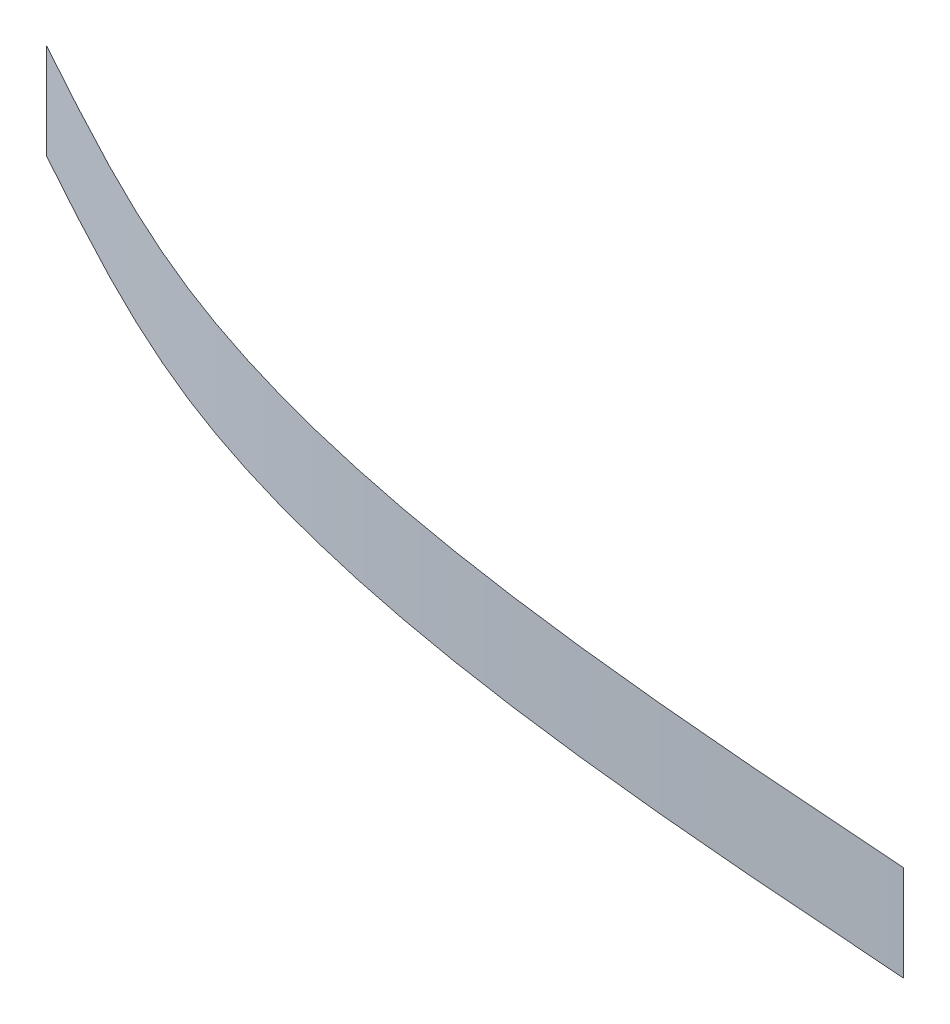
SolidWorks part; units mm, degrees
ref_plane "Ebene vorne" through (0, 0, 0) normal (0, 0, 1) x (1, 0, 0)
ref_plane "Ebene oben" through (0, 0, 0) normal (0, 1, 0) x (1, 0, 0)
ref_plane "Ebene rechts" through (0, 0, 0) normal (1, 0, 0) x (0, 0, -1)
sketch "Skizze1" plane through (0, 0, 0) normal (0, 1, 0) x (1, 0, 0)
  spline S0 degree 3 poles (0, 0) (-13.1052, 0.9056) (-43.8439, 3.0298) (-85.1773, 10.9073) (-109.9857, 24.5465) (-119.2184, 29.6225) knots 0 0 0 0 0.318154 0.746242 1 1 1 1
surface "Oberfläche-Linear austragen1" sketch "Skizze1" parameters "D1"=10
ref_plane "Ebene2" through (0, 10, 0) normal (0.9976, 0, 0.0689) x (0.0689, 0, -0.9976)
ref_plane "Ebene3" through (-120.6891, 0, -8.3402) normal (0.9976, 0, 0.0689) x (0.0689, 0, -0.9976)
ref_plane "Ebene4" through (1.4707, 0, -21.2823) normal (0.0689, 0, -0.9976) x (-0.9976, 0, -0.0689)
ref_plane "Ebene5" through (0, 0, 0) normal (-0.0689, 0, 0.9976) x (0.9976, 0, 0.0689)
sketch "Skizze3" plane through (1.4707, 0, -21.2823) normal (0.0689, 0, -0.9976) x (-0.9976, 0, -0.0689)
  line L3 (120.977, 33.782) -> (120.977, -33.782) construction
  arc A0 (120.977, 10) -> (105.977, 25) centre (105.977, 10) ccw
  dimension "D1" = 15
sketch3d "3D-Skizze1"
  spline S0 degree 3 poles (599.6954, 10, 1881.8165) (348.2237, 10, -108.0669) (139.3204, 10, 31.8785) (-208.2081, 10, -34.3551) (-262.2724, 10, -301.1886) (-1198.4746, 10, 1639.921) knots -4.431382 -4.431382 -4.431382 -4.431382 0.318154 0.746242 3.976544 3.976544 3.976544 3.976544 only from (0, 10, 0) to (-119.2184, 10, -29.6225) construction
  spline S1 degree 3 poles (0, 10, 0) (-13.1052, 10, -0.9056) (-43.8439, 10, -3.0298) (-85.1773, 10, -10.9073) (-109.9857, 10, -24.5465) (-119.2184, 10, -29.6225) knots 0 0 0 0 0.318154 0.746242 1 1 1 1
sketch "Skizze4" plane through (0, 10, 0) normal (0.9976, 0, 0.0689) x (0.0689, 0, -0.9976)
  arc A0 (7.807, 7.807) -> (0, 0) centre (7.807, 0) ccw
